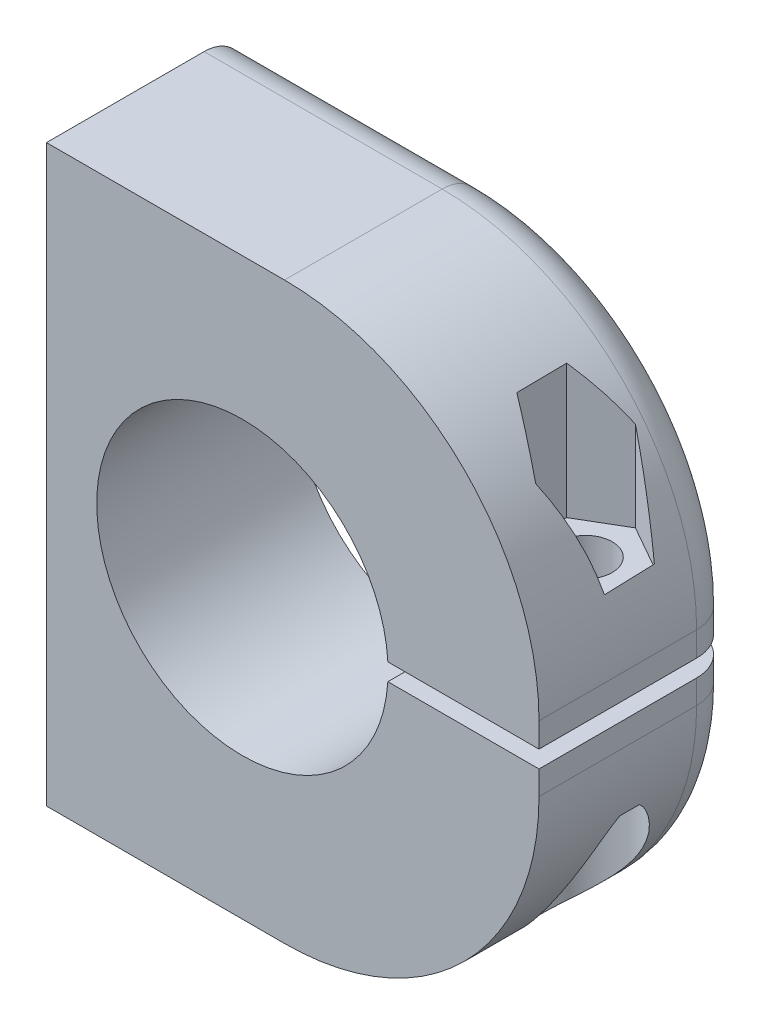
SolidWorks part; units mm, degrees
ref_plane "Plan de face" through (0, 0, 0) normal (0, 0, 1) x (1, 0, 0)
ref_plane "Plan de dessus" through (0, 0, 0) normal (0, 1, 0) x (1, 0, 0)
ref_plane "Plan de droite" through (0, 0, 0) normal (1, 0, 0) x (0, 0, -1)
sketch "Esquisse1" plane through (0, 0, 0) normal (0, 0, 1) x (1, 0, 0)
  line L1 (6, 5) -> (66, 5)
  line L2 (6, 5) -> (6, 75)
  line L3 (6, 75) -> (66, 75)
  line L4 (66, 5) -> (66, 75)
  dimension "D1" = 60
  dimension "D2" = 70
extrude "Extrusion1" add sketch "Esquisse1" along normal blind 24.2
sketch "Esquisse2" plane through (0, 0, 0) normal (0, 0, -1) x (-1, 0, 0)
  line L0 (-29.8677, 40) -> (-29.8677, 86.5365) construction
  line L1 (-66, 41.0081) -> (-47.589, 41.0081)
  line L2 (-66, 41.0081) -> (-66, 38.9158)
  line L3 (-66, 40) -> (0, 40) construction
  line L4 (-66, 5) -> (-66, 75) construction
  line L5 (-66, 38.9158) -> (-47.5845, 38.9158)
  arc A1 (-47.5845, 38.9158) -> (-47.589, 41.0081) centre (-29.8677, 40) ccw
  dimension "D1" = 17.75
extrude "Enlèv. mat.-Extru.1" cut sketch "Esquisse2" against normal blind 24.2
sketch "Esquisse3" plane through (0, 75, 0) normal (0, 1, 0) x (-1, 0, 0)
  line L0 (-66, 12.1) -> (-6, 12.1) construction
  line L1 (-66, 24.2) -> (-66, 0) construction
  line L2 (-6, 24.2) -> (-6, 0) construction
  circle A0 centre (-59.5732, 12.1) radius 3.25
  dimension "D1" = 6.5
extrude "Enlèv. mat.-Extru.2" cut sketch "Esquisse3" against normal through all
sketch "Esquisse10" plane through (0, 5, 0) normal (0, -1, 0) x (1, 0, 0)
  circle A0 centre (59.5732, 12.1) radius 5.5
extrude "Enlèv. mat.-Extru.9" cut sketch "Esquisse10" against normal blind 23
sketch "Esquisse6" plane through (0, 75, 0) normal (0, 1, 0) x (1, 0, 0)
  line L1 (54.2514, -9.0782) -> (54.2953, -15.1979)
  line L2 (54.2953, -15.1979) -> (59.6171, -18.2198)
  line L3 (59.6171, -18.2198) -> (64.895, -15.1218)
  line L4 (64.895, -15.1218) -> (64.8511, -9.0021)
  line L5 (64.8511, -9.0021) -> (59.5293, -5.9802)
  line L6 (59.5293, -5.9802) -> (54.2514, -9.0782)
  circle A0 centre (59.5732, -12.1) radius 5.3 construction
  dimension "D1" = 10.6
extrude "Enlèv. mat.-Extru.5" cut sketch "Esquisse6" against normal blind 23
sketch "Esquisse5" plane through (6, 0, 0) normal (-1, 0, 0) x (0, 0, 1)
  line L2 (24.2, 75) -> (0, 75) construction
  line L3 (24.2, 75) -> (24.2, 5) construction
  line L4 (24.2, 5) -> (0, 5) construction
  circle A0 centre (12.2, 13) radius 3.25
  circle A1 centre (12.2, 67) radius 3.25
  dimension "D1" = 8
  dimension "D5" = 54
  dimension "D6" = 6.5
  dimension "D7" = 6.5
  dimension "D2" = 8
  dimension "D3" = 12
  dimension "D4" = 12
extrude "Enlèv. mat.-Extru.4" cut sketch "Esquisse5" against normal blind 40
ref_plane "Plan1" through (21, 0, 0) normal (-1, 0, 0) x (0, 0, 1)
sketch "Esquisse9" plane through (21, 0, 0) normal (-1, 0, 0) x (0, 0, 1)
  line L1 (18.2622, 13) -> (15.2311, 18.25)
  line L2 (15.2311, 18.25) -> (-5.0871, 18.3)
  line L3 (-5.0871, 18.3) -> (-5.0871, 13)
  line L4 (-5.0871, 13) -> (-5.0871, 7.75)
  line L5 (-5.0871, 7.75) -> (15.2311, 7.75)
  line L6 (15.2311, 7.75) -> (18.2622, 13)
  line L7 (18.2622, 67) -> (15.2311, 72.25)
  line L8 (15.2311, 72.25) -> (-5.0871, 72.25)
  line L9 (-5.0871, 72.25) -> (-5.0871, 67)
  line L10 (-5.0871, 67) -> (-5.0871, 61.75)
  line L11 (-5.0871, 61.75) -> (15.2311, 61.75)
  line L12 (15.2311, 61.75) -> (18.2622, 67)
  dimension "D2" = 10.5
extrude "Enlèv. mat.-Extru.6" cut sketch "Esquisse9" along normal blind 5.3
fillet "Congé5" radius 31 2 edges at (66, 75, 12.1) (66, 5, 12.1)
fillet "Congé6" radius 5 6 edges at (20.5, 5, 0) (56.9203, 14.0797, 0) (66, 37.4579, 0) (66, 42.504, 0) (56.9203, 65.9203, 0) (20.5, 75, 0)
